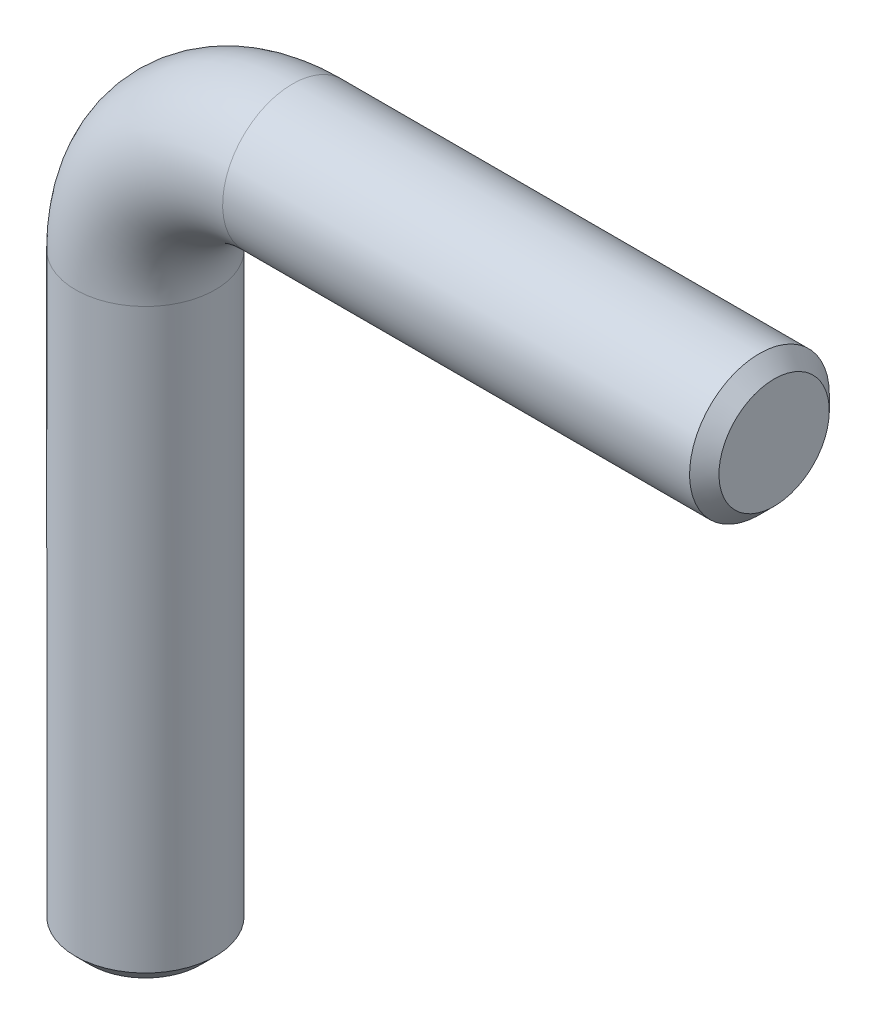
SolidWorks part; units mm, degrees
ref_plane "LAT. ESQUERDO" through (0, 0, 0) normal (0, 0, 1) x (1, 0, 0)
ref_plane "SUPERIOR" through (0, 0, 0) normal (0, 1, 0) x (1, 0, 0)
ref_plane "FRONTAL" through (0, 0, 0) normal (1, 0, 0) x (0, 0, -1)
sketch "Esboço1" plane through (0, 0, 0) normal (0, 0, 1) x (1, 0, 0)
  line L0 (0, 0) -> (0, 40.25)
  line L1 (10, 50.25) -> (42.75, 50.25)
  arc A0 (0, 40.25) -> (10, 50.25) centre (10, 40.25) cw
  dimension "D3" = 10
  dimension "D1" = 50.25
  dimension "D2" = 42.75
sketch "Esboço2" plane through (0, 0, 0) normal (0, 1, 0) x (1, 0, 0)
  circle A0 centre (0, 0) radius 4.75
  dimension "D1" = 9.5
sweep "Varredura1" add profiles "Esboço2" path "Esboço1"
chamfer "Chanfro1" distance 1 angle 45 2 edges at (42.75, 50.25, 4.75) (0, 0, 4.75)
